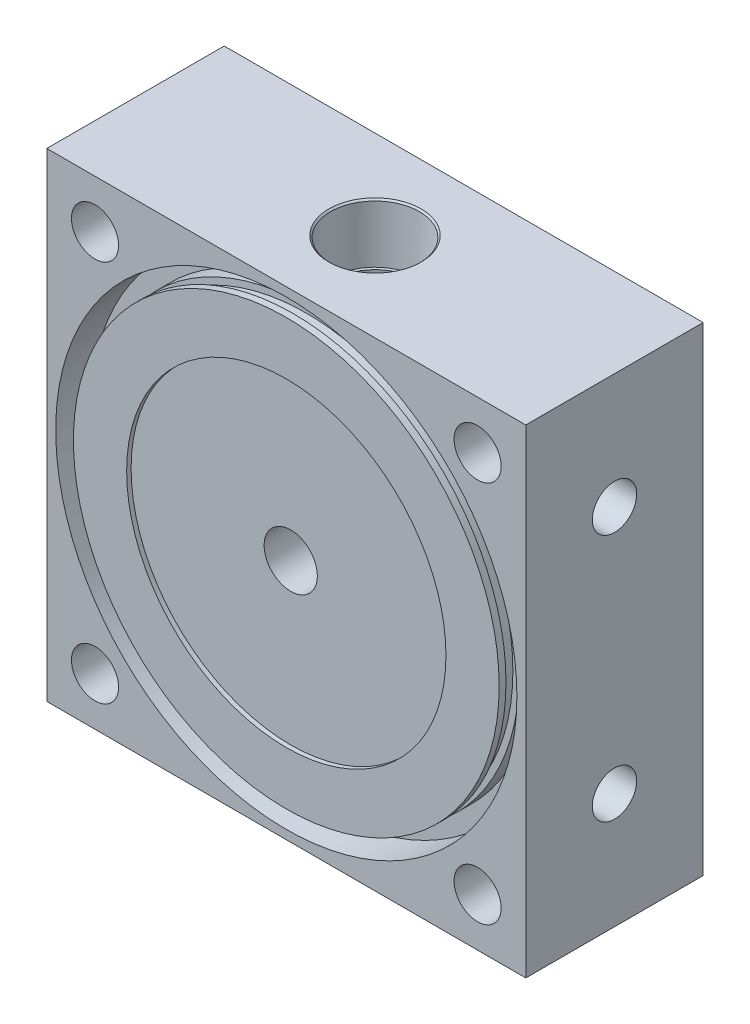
SolidWorks part; units mm, degrees
ref_plane "Front Plane" through (0, 0, 0) normal (0, 0, 1) x (1, 0, 0)
ref_plane "Top Plane" through (0, 0, 0) normal (0, 1, 0) x (1, 0, 0)
ref_plane "Right Plane" through (0, 0, 0) normal (1, 0, 0) x (0, 0, -1)
sketch "Sketch1" plane through (0, 0, 0) normal (0, 0, 1) x (1, 0, 0)
  line L0 (-42.8625, 42.8625) -> (42.8625, -42.8625) construction
  line L1 (-42.8625, -42.8625) -> (42.8625, -42.8625)
  line L2 (-42.8625, -42.8625) -> (-42.8625, 42.8625)
  line L3 (-42.8625, 42.8625) -> (42.8625, 42.8625)
  line L4 (42.8625, -42.8625) -> (42.8625, 42.8625)
  dimension "D2" = 85.725
extrude "Extrude1" add sketch "Sketch1" along normal blind 31.75
sketch "Sketch2" plane through (0, 0, 31.75) normal (0, 0, 1) x (1, 0, 0)
  circle A0 centre (0, 0) radius 38.1
  circle A1 centre (0, 0) radius 41.275
  dimension "D1" = 76.2
  dimension "D2" = 3.175
extrude "Cut-Extrude1" cut sketch "Sketch2" against normal blind 6.35
hole_wizard "5/16 Clearance Hole1" positions "Sketch12" profile "Sketch13" hole size "5/16" standard "Ansi Inch"
sketch "Sketch12" plane through (0, 0, 31.75) normal (0, 0, 1) x (1, 0, 0)
  line L0 (-42.8625, 42.8625) -> (42.8625, -42.8625) construction
  line L3 (42.8625, 42.8625) -> (-42.8625, -42.8625) construction
  circle A0 centre (0, 0) radius 48.4187 construction
  circle A1 centre (0, 0) radius 41.275 construction
  point P0 (-34.2372, 34.2372)
  point P1 (34.2372, 34.2372)
  point P3 (34.2372, -34.2372)
  point P5 (-34.2372, -34.2372)
  dimension "D1" = 7.1437
sketch "Sketch13" plane through (-34.2372, 34.2372, 31.75) normal (1, 0, 0) x (0, -1, 0)
  line L0 (0, 0) -> (0, 31.75)
  line L1 (0, 31.75) -> (4.2164, 31.75)
  line L2 (4.2164, 31.75) -> (4.2164, 0)
  line L5 (4.2164, 0) -> (0, 0)
  line L11 (0, -6.35) -> (0, 107.95) construction
  dimension "Thru Hole Dia." = 8.4328
  dimension "Thru Hole Depth" = 31.75
hole_wizard "3/8 NPT Tapped Hole1" positions "Sketch5" profile "Sketch4" size "3/8" standard "Ansi Inch"
sketch "Sketch5" plane through (0, 42.8625, 0) normal (0, 1, 0) x (-1, 0, 0)
  line L0 (-42.8625, 0) -> (42.8625, 0) construction
  line L1 (42.8625, 31.75) -> (42.8625, 0) construction
  point P0 (0, 15.875)
  point P4 (0, 0)
  point P7 (42.8625, 15.875)
sketch "Sketch4" plane through (0, 42.8625, 15.875) normal (1, 0, 0) x (0, 0, 1)
  line L0 (0, 0) -> (0, 21.6876)
  line L1 (7.1374, 17.399) -> (0, 21.6876)
  line L2 (-7.1374, 17.399) -> (0, 21.6876) construction
  line L3 (7.1374, 17.399) -> (7.1374, 10.3378)
  line L4 (7.1374, 10.3378) -> (7.6647, 10.3378)
  line L5 (7.6647, 10.3378) -> (7.9655, 0.2895)
  line L6 (7.9655, 0.2895) -> (8.255, 0)
  line L7 (8.255, 0) -> (0, 0)
  line L8 (0, -6.35) -> (0, 107.95) construction
  line L9 (-7.9655, 0.2895) -> (-8.255, 0) construction
  line L11 (-7.1374, 10.3378) -> (-7.6647, 10.3378) construction
  line L12 (-7.6647, 10.3378) -> (-7.9655, 0.2895) construction
  dimension "Tap Drill Dia." = 14.2748
  dimension "Tap Drill Depth" = 17.399
  dimension "Thread Dia." = 15.9311
  dimension "Thread Angle" = 3.43
  dimension "Thread Depth" = 10.3378
  dimension "C'Sink Dia." = 16.51
  dimension "C'Sink Angle" = 90
  dimension "Drill Angle" = 118
hole_wizard "3/8 (0.375) Diameter Hole1" positions "Sketch8" profile "Sketch7" hole size "3/8" standard "Ansi Inch"
sketch "Sketch8" plane through (0, 0, 31.75) normal (0, 0, 1) x (1, 0, 0)
  point P0 (0, 0)
sketch "Sketch7" plane through (0, 0, 31.75) normal (1, 0, 0) x (0, -1, 0)
  line L0 (0, 0) -> (0, 18.7366)
  line L1 (0, 18.7366) -> (4.7625, 15.875)
  line L2 (4.7625, 15.875) -> (4.7625, 0)
  line L5 (4.7625, 0) -> (0, 0)
  line L10 (0, 18.7366) -> (-4.7625, 15.875) construction
  line L11 (0, -6.35) -> (0, 107.95) construction
  dimension "Hole Dia." = 9.525
  dimension "Hole Depth" = 15.875
  dimension "Drill Angle" = 118
sketch "Sketch9" plane through (0, 0, 31.75) normal (0, 0, 1) x (1, 0, 0)
  circle A1 centre (0, 0) radius 28.575
  circle A2 centre (0, 0) radius 38.1 construction
  dimension "D1" = 9.525
extrude "Cut-Extrude3" cut sketch "Sketch9" against normal blind 0.7937
sketch "Sketch10" plane through (0, 0, 0) normal (1, 0, 0) x (0, 0, -1)
  line L0 (-30.5308, 38.1) -> (-30.5308, 36.957)
  line L1 (-25.4, 38.1) -> (-31.75, 38.1) construction
  line L2 (-30.5308, 36.957) -> (-28.1495, 36.957)
  line L3 (-28.1495, 36.957) -> (-28.1495, 38.1)
  line L4 (-28.1495, 38.1) -> (-30.5308, 38.1)
  line L5 (0, 0) -> (-34.454, 0) construction
  dimension "D1" = 1.2192
  dimension "D2" = 2.3813
  dimension "D3" = 1.143
revolve "Cut-Revolve1" cut sketch "Sketch10" angle 360 about L5
sketch "Sketch14" plane through (0, 0, 0) normal (1, 0, 0) x (0, 0, -1)
  line L0 (-15.875, 42.8625) -> (-10.7157, 42.8625)
  line L1 (-10.7157, 42.8625) -> (-10.7157, -15.875)
  line L2 (-10.7157, -15.875) -> (-11.9062, -15.875)
  line L3 (-11.9062, -15.875) -> (-11.9062, -16.6916)
  line L4 (-11.9062, -16.6916) -> (-12.7, -18.3938)
  line L5 (-12.7, -18.3938) -> (-12.7, -42.8625)
  line L6 (-12.7, -42.8625) -> (-15.875, -42.8625)
  line L7 (-15.875, -42.8625) -> (-15.875, 42.8625)
  line L8 (-31.75, 42.8625) -> (0, 42.8625) construction
  line L9 (-31.75, -42.8625) -> (0, -42.8625) construction
  line L10 (-15.875, 42.8625) -> (-15.875, 53.873) construction
  line L11 (-15.875, 42.573) -> (-15.875, 32.5247) construction
  dimension "D1" = 5.1593
  dimension "D2" = 58.7375
  dimension "D3" = 7.9375
  dimension "D4" = 6.35
  dimension "D5" = 25
  dimension "D6" = 0.8166
  dimension "D7" = 90
revolve "Cut-Revolve2" cut sketch "Sketch14" angle 360 about L10
hole_wizard "3/8-16 Tapped Hole1" positions "Sketch16" profile "Sketch15" tap size "3/8-16" standard "Example Inch"
sketch "Sketch16" plane through (42.8625, 0, 0) normal (1, 0, 0) x (0, 0, -1)
  line L0 (0, 0) -> (-19.3598, 0) construction
  line L1 (0, -42.8625) -> (0, 42.8625) construction
  line L3 (-31.75, -42.8625) -> (0, -42.8625) construction
  point P0 (-15.875, 22.225)
  point P1 (-15.875, -22.225)
  point P12 (-15.875, -42.8625)
  dimension "D1" = 44.45
sketch "Sketch15" plane through (42.8625, 22.225, 15.875) normal (0, 1, 0) x (0, 0, -1)
  line L0 (0, 0) -> (0, 29.3722)
  line L1 (0, 29.3722) -> (3.9687, 26.9875)
  line L2 (3.9687, 26.9875) -> (3.9687, 0)
  line L5 (3.9687, 0) -> (0, 0)
  line L10 (0, 29.3722) -> (-3.9688, 26.9875) construction
  line L11 (0, -6.35) -> (0, 107.95) construction
  dimension "Tap Drill Dia." = 7.9375
  dimension "Tap Drill Depth" = 26.9875
  dimension "Drill Angle" = 118
